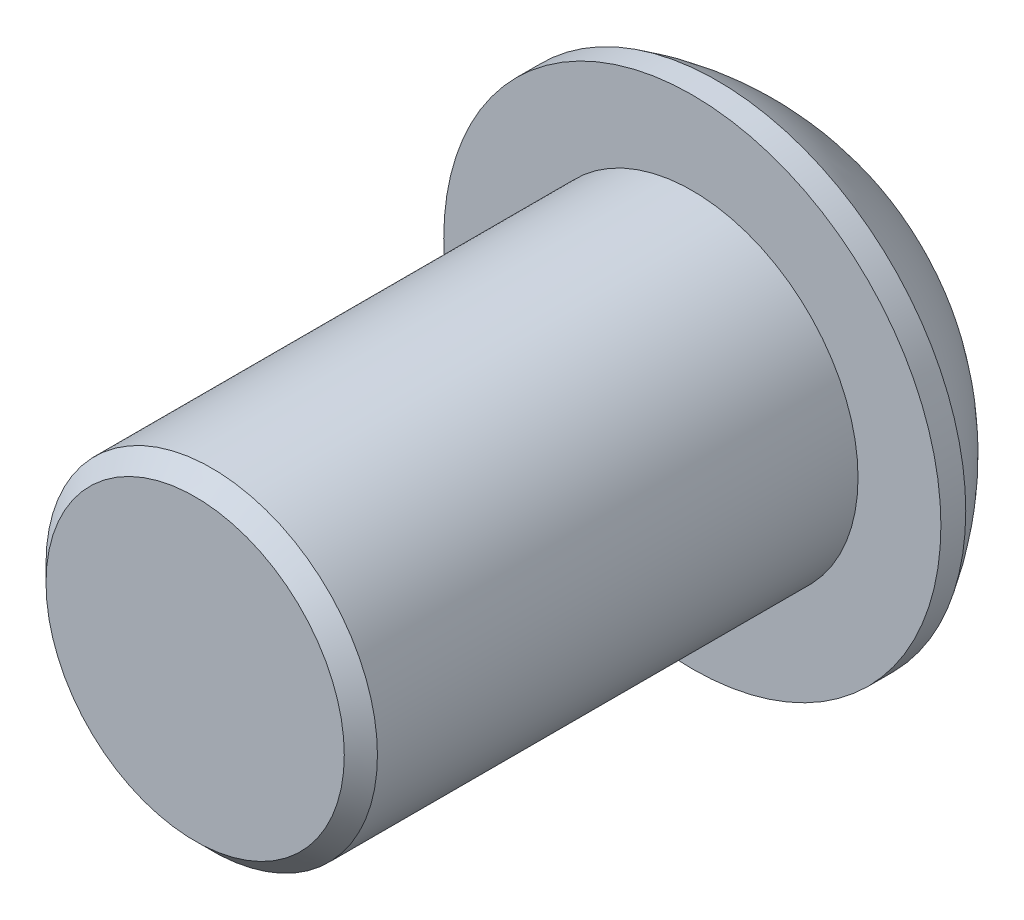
SolidWorks part; units mm, degrees
ref_plane "Front Plane" through (0, 0, 0) normal (0, 0, 1) x (1, 0, 0)
ref_plane "Top Plane" through (0, 0, 0) normal (0, 1, 0) x (1, 0, 0)
ref_plane "Right Plane" through (0, 0, 0) normal (1, 0, 0) x (0, 0, -1)
sketch "Sketch1" plane through (0, 0, 0) normal (0, 0, 1) x (1, 0, 0)
  circle A0 centre (0, 0) radius 2
  dimension "D1" = 4
extrude "Extrude1" add sketch "Sketch1" along normal blind 6
chamfer "Chamfer1" distance 0.2 angle 45 1 edges at (2, 0, 6)
sketch "Sketch3" plane through (0, 0, 0) normal (0, 1, 0) x (1, 0, 0)
  line L0 (0, 0) -> (-3, 0)
  line L1 (0, 2) -> (0, 0)
  line L2 (-3, 0) -> (-3, 0.3)
  line L5 (0, 0) -> (0, 3.6806) construction
  arc A0 (-3, 0.3) -> (0, 2) centre (0.0017, -1.5) cw
  dimension "D2" = 0.3
  dimension "D3" = 3.5
  dimension "D1" = 6
  dimension "D4" = 2
revolve "Revolve1" add sketch "Sketch3" angle 360 about L5
sketch "Sketch4" plane through (0, 0, 0) normal (0, 0, 1) x (1, 0, 0)
  line L1 (0.25, 3.1406) -> (-0.25, 3.1406)
  line L2 (0.25, 3.1406) -> (0.25, -3.1406)
  line L3 (0.25, -3.1406) -> (-0.25, -3.1406)
  line L4 (-0.25, 3.1406) -> (-0.25, -3.1406)
  line L5 (0.25, 3.1406) -> (-0.25, -3.1406) construction
  line L6 (0.25, -3.1406) -> (-0.25, 3.1406) construction
  point P0 (0, 0)
  dimension "D1" = 0.5
extrude "Extrude2" cut sketch "Sketch4" against normal through all from offset 1
